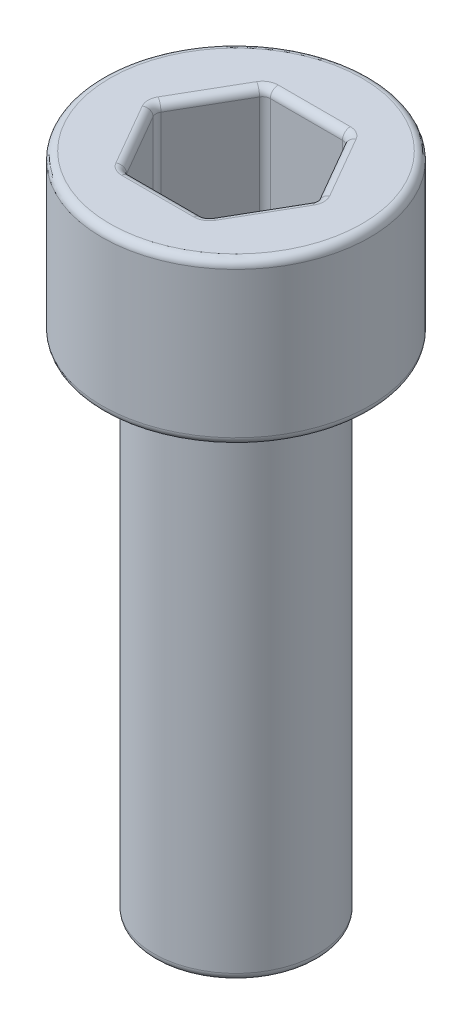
SolidWorks part; units mm, degrees
ref_plane "Front" through (0, 0, 0) normal (0, 0, 1) x (1, 0, 0)
ref_plane "Top" through (0, 0, 0) normal (0, 1, 0) x (1, 0, 0)
ref_plane "Right" through (0, 0, 0) normal (1, 0, 0) x (0, 0, -1)
sketch "草图1" plane through (0, 0, 0) normal (0, 1, 0) x (1, 0, 0)
  circle A0 centre (0, 0) radius 2.085
  dimension "螺丝直径" = 4.17
extrude "凸台-拉伸1" add sketch "草图1" against normal blind 12.7
sketch "草图2" plane through (0, 0, 0) normal (0, 1, 0) x (1, 0, 0)
  circle A0 centre (0, 0) radius 3.4
  dimension "头部直径" = 6.8
extrude "凸台-拉伸2" add sketch "草图2" along normal blind 4.1
sketch "草图3" plane through (0, 4.1, 0) normal (0, 1, 0) x (1, 0, 0)
  line L1 (2.0622, 0) -> (1.0311, 1.7859)
  line L2 (1.0311, 1.7859) -> (-1.0311, 1.7859)
  line L3 (-1.0311, 1.7859) -> (-2.0622, 0)
  line L4 (-2.0622, 0) -> (-1.0311, -1.7859)
  line L5 (-1.0311, -1.7859) -> (1.0311, -1.7859)
  line L6 (1.0311, -1.7859) -> (2.0622, 0)
  circle A0 centre (0, 0) radius 1.7859 construction
  dimension "内六角对边" = 3.5719
extrude "切除-拉伸1" cut sketch "草图3" against normal blind 3
fillet "圆角1" radius 0.2 21 edges at (0, 1.1, 1.7859) (0, 4.1, 1.7859) (1.0311, 2.6, 1.7859) (1.5467, 1.1, 0.893) (1.5467, 4.1, 0.893) (2.0622, 2.6, 0) (1.5467, 1.1, -0.893) (1.5467, 4.1, -0.893) (-1.5467, 1.1, 0.893) (-1.0311, 2.6, 1.7859) (-1.5467, 4.1, 0.893) (-1.5467, 1.1, -0.893) (-2.0622, 2.6, 0) (-1.5467, 4.1, -0.893) (1.0311, 2.6, -1.7859) (0, 1.1, -1.7859) (-1.0311, 2.6, -1.7859) (0, 4.1, -1.7859) (0, 0, 3.4) (0, 4.1, 3.4) (0, -12.7, 2.085)
other "冻结***"
